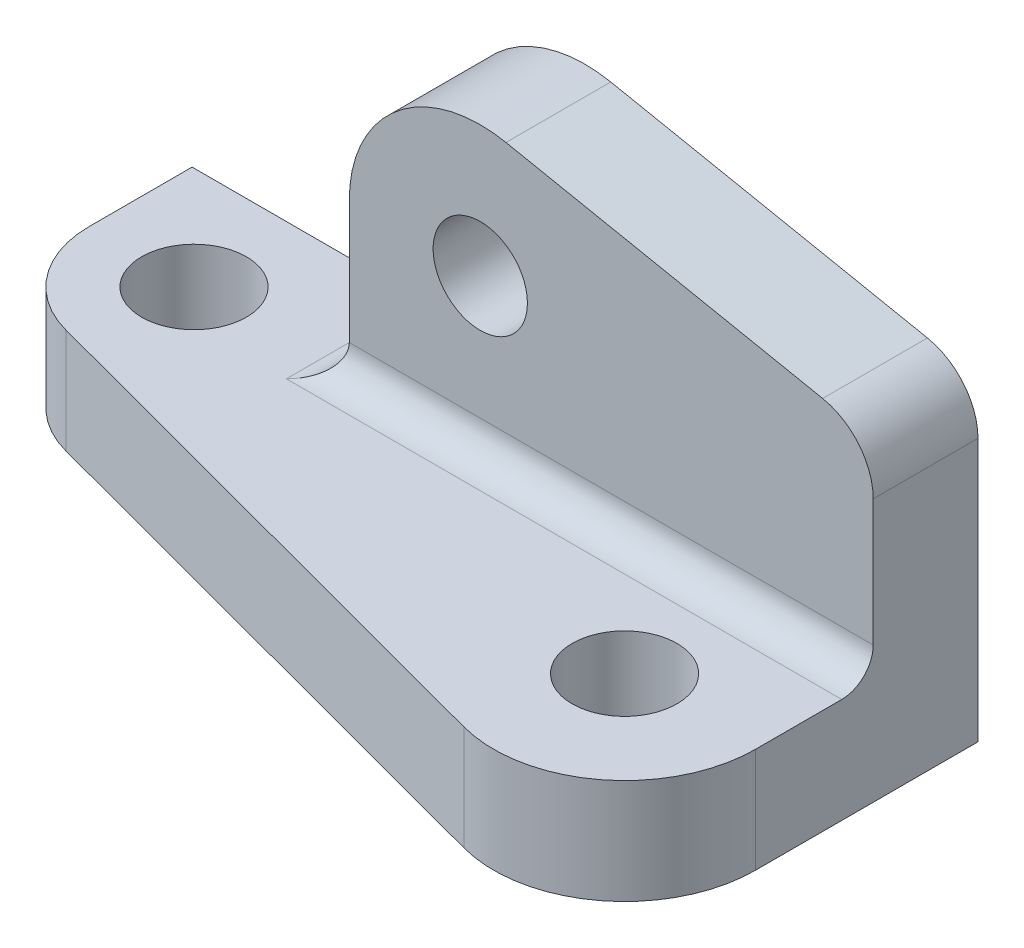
SolidWorks part; units mm, degrees
ref_plane "Front Plane" through (0, 0, 0) normal (0, 0, 1) x (1, 0, 0)
ref_plane "Top Plane" through (0, 0, 0) normal (0, 1, 0) x (1, 0, 0)
ref_plane "Right Plane" through (0, 0, 0) normal (1, 0, 0) x (0, 0, -1)
sketch "Sketch1" plane through (0, 0, 0) normal (0, 1, 0) x (1, 0, 0)
  line L1 (0, 0) -> (150, 0)
  line L2 (0, 0) -> (0, -35)
  line L3 (0, -35) -> (150, -75)
  line L4 (150, 0) -> (150, -75)
  dimension "D1" = 150
  dimension "D2" = 75
  dimension "D3" = 35
extrude "Extrude1" add sketch "Sketch1" along normal blind 20
sketch "Sketch2" plane through (0, 0, 0) normal (0, 0, -1) x (-1, 0, 0)
  line L1 (-150, 0) -> (-50, 0)
  line L2 (-150, 0) -> (-150, 60)
  line L3 (-150, 60) -> (-50, 80)
  line L4 (-50, 0) -> (-50, 80)
  dimension "D1" = 100
  dimension "D2" = 80
  dimension "D3" = 60
extrude "Extrude2" add sketch "Sketch2" against normal blind 20
fillet "Fillet1" radius 25 2 edges at (50, 80, 10) (150, 10, 75)
fillet "Fillet2" radius 20 1 edges at (0, 10, 35)
fillet "Fillet3" radius 12 1 edges at (150, 60, 10)
fillet "Fillet4" radius 6 2 edges at (50, 20, 10) (100, 20, 20)
hole_wizard "M20.0 (20) Diameter Hole1" positions "Sketch4" profile "Sketch3" hole size "M20.0" standard "Ansi Metric"
sketch "Sketch4" plane through (0, 20, 0) normal (0, 1, 0) x (-1, 0, 0)
  arc A0 (0, 19.6344) -> (-14.8467, 38.9591) centre (-20, 19.6344) ccw construction
  arc A1 (-118.5584, 66.6156) -> (-150, 42.4597) centre (-125, 42.4597) ccw construction
  point P0 (-125, 42.4597)
  point P1 (-20, 19.6344)
sketch "Sketch3" plane through (125, 20, 42.4597) normal (1, 0, 0) x (0, 0, 1)
  line L0 (0, 0) -> (0, 20)
  line L1 (0, 20) -> (10, 20)
  line L2 (10, 20) -> (10, 0)
  line L5 (10, 0) -> (0, 0)
  line L11 (0, -6.35) -> (0, 107.95) construction
  dimension "Thru Hole Dia." = 20
  dimension "Thru Hole Depth" = 20
hole_wizard "M18.0 (18) Diameter Hole1" positions "Sketch5" profile "Sketch6" hole size "M18.0" standard "Ansi Metric"
sketch "Sketch5" plane through (130.8799, 20.2642, 20) normal (0, 0, 1) x (1, 0, 0)
  arc A2 (-50.977, 53.7552) -> (-80.8799, 29.2407) centre (-55.8799, 29.2407) ccw construction
  point P1 (-55.8799, 29.2407)
sketch "Sketch6" plane through (75, 49.5049, 20) normal (1, 0, 0) x (0, -1, 0)
  line L0 (0, 0) -> (0, 20)
  line L1 (0, 20) -> (9, 20)
  line L2 (9, 20) -> (9, 0)
  line L5 (9, 0) -> (0, 0)
  line L11 (0, -6.35) -> (0, 107.95) construction
  dimension "Thru Hole Dia." = 18
  dimension "Thru Hole Depth" = 20
